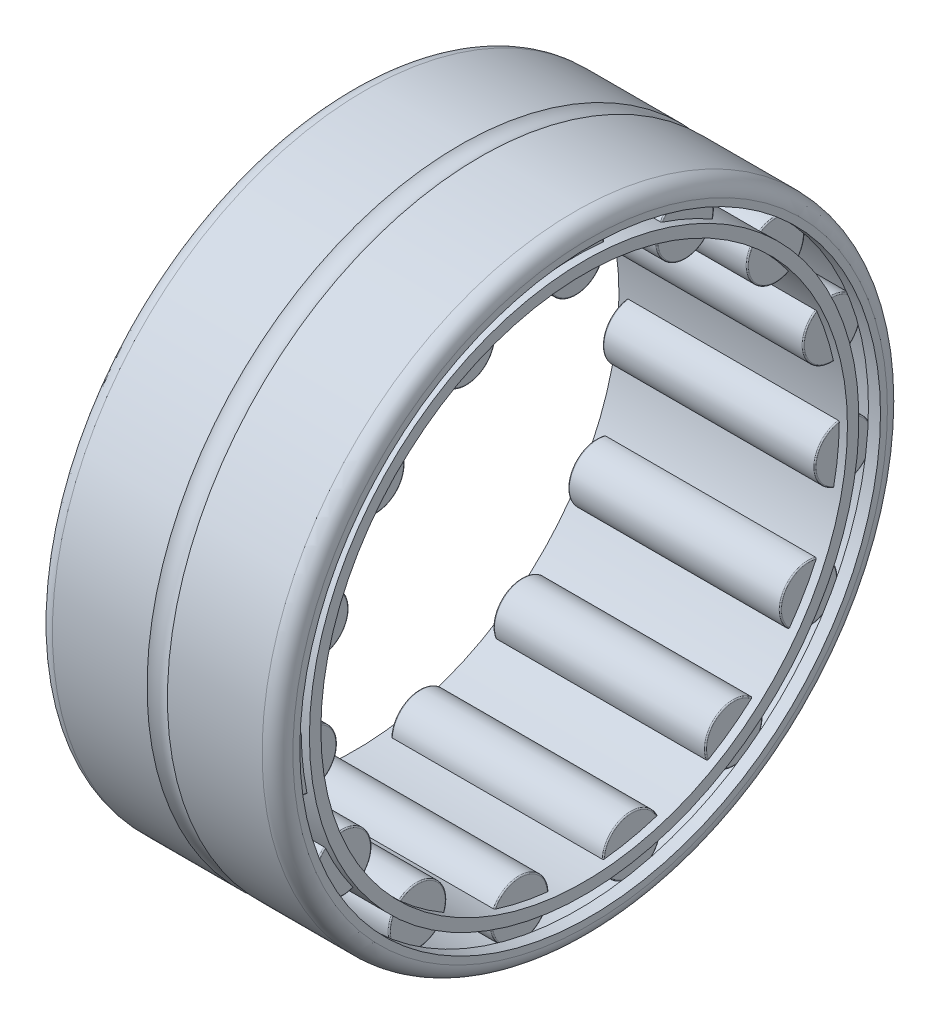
SolidWorks part; units mm, degrees
ref_plane "Plane1" through (0, 0, 0) normal (0, 0, 1) x (1, 0, 0)
ref_plane "Plane2" through (0, 0, 0) normal (0, 1, 0) x (1, 0, 0)
ref_plane "Plane3" through (0, 0, 0) normal (1, 0, 0) x (0, 0, -1)
sketch "Clipboard" plane through (0, 0, 0) normal (0, 0, 1) x (1, 0, 0)
  line L0 (-10, 0) -> (10, 0) construction
  line L1 (41.1529, 1.4371) -> (62.7517, -4.3503)
  line L2 (41.1529, 1.4371) -> (75.4583, 10.6292)
  line L3 (41.1529, 1.4371) -> (62.7517, -4.3503)
  line L4 (41.1529, 1.4371) -> (-22.3471, -0.7804)
  dimension "BallCLRad" = 35.5155
  dimension "Count" = 15
  dimension "Show_count" = 15
  dimension "Max_count" = 15
  dimension "Min_count" = 2
  dimension "Bore" = 63.5
sketch "InnRacSke" plane through (0, 0, 0) normal (0, 0, 1) x (1, 0, 0)
  line L0 (-14.2875, 38.3286) -> (-15.875, 38.3286)
  line L1 (-15.875, 38.3286) -> (-15.875, 39.243)
  line L2 (-13.843, 41.275) -> (-1.344, 41.275)
  line L3 (1.344, 41.275) -> (13.843, 41.275)
  line L4 (15.875, 39.243) -> (15.875, 38.3286)
  line L5 (15.875, 38.3286) -> (14.2875, 38.3286)
  line L6 (14.2875, 38.3286) -> (14.2875, 39.2811)
  line L7 (14.2875, 39.2811) -> (-14.2875, 39.2811)
  line L8 (-14.2875, 39.2811) -> (-14.2875, 38.3286)
  line L9 (-31.75, 0) -> (31.75, 0) construction
  arc A0 (-15.875, 39.243) -> (-13.843, 41.275) centre (-13.843, 39.243) cw
  arc A1 (-1.344, 41.275) -> (1.344, 41.275) centre (0, 42.799) ccw
  arc A2 (13.843, 41.275) -> (15.875, 39.243) centre (13.843, 39.243) cw
  dimension "radius" = 2.032
  dimension "D1" = 78.5622
  dimension "OD" = 82.55
  dimension "Width" = 31.75
  dimension "groove_dp" = 0.9525
  dimension "Cyl_Len" = 28.575
  dimension "offset" = 1.524
  dimension "halfCyl" = 14.2875
revolve "Race" add sketch "InnRacSke" angle 360 about L9
sketch "RolDetSke" plane through (0, 0, 0) normal (0, 0, 1) x (1, 0, 0)
  line L0 (-14.0018, 39.1427) -> (-14.0017, 35.5155)
  line L1 (-14.0017, 35.5155) -> (14.0017, 35.5155)
  line L2 (14.0017, 35.5155) -> (14.0018, 39.1427)
  line L3 (13.8506, 39.2938) -> (-13.8506, 39.2938)
  line L4 (-28.575, 35.5155) -> (28.575, 35.5155) construction
  arc A0 (14.0018, 39.1427) -> (13.8506, 39.2938) centre (13.8506, 39.1427) ccw
  arc A1 (-13.8506, 39.2938) -> (-14.0018, 39.1427) centre (-13.8506, 39.1427) ccw
  dimension "Roller_radius" = 0.1511
  dimension "Roller_diameter" = 7.5565
  dimension "Roller_length" = 28.0035
  dimension "RollerCLRad" = 35.5155
  dimension "halfLength" = 14.0017
revolve "RollerDetailed" add sketch "RolDetSke" angle 360 about L4
ref_axis "Axis1" through (-50, 0, 0) along (1, 0, 0)
sketch "CagSpiSke" plane through (0, 0, 0) normal (0, 0, 1) x (1, 0, 0)
  line L0 (15.0812, 34.7599) -> (15.0812, 36.2712)
  line L1 (15.0812, 36.2712) -> (-15.0813, 36.2712)
  line L2 (-15.0813, 36.2712) -> (-15.0813, 34.7599)
  line L3 (-15.0813, 34.7599) -> (15.0812, 34.7599)
  line L4 (-31.75, 0) -> (31.75, 0) construction
  dimension "Cage_width" = 30.1625
  dimension "D2" = 69.5198
  dimension "Cage_thickness" = 1.5113
  dimension "halfWidth" = 15.0812
revolve "CageSpine" add sketch "CagSpiSke" angle 360 about L4
pattern_circular "RollersDetailed" count 15 every 24 about axis through (-50, 0, 0) along (1, 0, 0) of "RollerDetailed"
sketch "RolSimSke" plane through (0, 0, 0) normal (0, 0, 1) x (1, 0, 0)
  line L0 (-25.4, 0) -> (25.4, 0) construction
  line L2 (-13.8506, 39.3065) -> (13.8506, 39.3065)
  line L3 (-14.0018, 39.1554) -> (-14.0018, 31.9011)
  line L4 (-13.8506, 31.75) -> (13.8506, 31.75)
  line L5 (14.0017, 39.1554) -> (14.0017, 31.9011)
  arc A0 (-14.0018, 31.9011) -> (-13.8506, 31.75) centre (-13.8506, 31.9011) ccw
  arc A1 (-13.8506, 39.3065) -> (-14.0018, 39.1554) centre (-13.8506, 39.1554) ccw
  arc A2 (14.0017, 39.1554) -> (13.8506, 39.3065) centre (13.8506, 39.1554) ccw
  arc A3 (13.8506, 31.75) -> (14.0017, 31.9011) centre (13.8506, 31.9011) ccw
  point P10 (-14.0018, 31.75)
  point P15 (14.0017, 39.3065)
  point P18 (14.0017, 31.75)
  dimension "D1" = 0.1511
  dimension "Bore" = 63.5
  dimension "Roller_length" = 28.0035
  dimension "Roller_diameter" = 7.5565
  dimension "halfWidth" = 14.0017
revolve "RollersSimplified" [suppressed] add sketch "RolSimSke" angle 360 about L0
equation "\"BallCLRad@Clipboard\" =  ( \"D1@InnRacSke\" + \"Bore@Clipboard\" )  / 4"
equation "\"RollerCLRad@RolDetSke\" = \"BallCLRad@Clipboard\""
equation "\"offset@InnRacSke\" = \"radius@InnRacSke\" * .75"
equation "\"halfCyl@InnRacSke\" = \"Cyl_Len@InnRacSke\" / 2"
equation "\"Roller_diameter@RolDetSke\" =  ( \"D1@InnRacSke\" - \"Bore@Clipboard\" )  / 2 + .001"
equation "\"Roller_radius@RolDetSke\" = \"Roller_diameter@RolDetSke\" / 50"
equation "\"Roller_length@RolDetSke\" = \"Cyl_Len@InnRacSke\" * .98"
equation "\"halfLength@RolDetSke\" = \"Roller_length@RolDetSke\" / 2"
equation "\"Cage_width@CagSpiSke\" =  ( \"Cyl_Len@InnRacSke\" + \"Width@InnRacSke\" )  / 2"
equation "\"halfWidth@CagSpiSke\" = \"Cage_width@CagSpiSke\" / 2"
equation "\"Cage_thickness@CagSpiSke\"  = \"Roller_diameter@RolDetSke\" / 5"
equation "\"D2@CagSpiSke\" =  \"RollerCLRad@RolDetSke\" * 2 - \"Cage_thickness@CagSpiSke\""
equation "\"Roller_length@RolSimSke\" = \"Cyl_Len@InnRacSke\" * .98"
equation "\"halfWidth@RolSimSke\" = \"Roller_length@RolSimSke\" / 2"
equation "\"D1@RolSimSke\" = \"Roller_radius@RolDetSke\""
equation "\"Roller_diameter@RolSimSke\" =  ( \"D1@InnRacSke\" - \"Bore@Clipboard\" )  / 2 + .001"
equation "\"Max_count@Clipboard\" = int( 3.14159265 / atn(( \"Roller_diameter@RolDetSke\" / 2) / sqr( \"RollerCLRad@RolDetSke\"  *  \"RollerCLRad@RolDetSke\" - ( \"Roller_diameter@RolDetSke\" / 2) *  ( \"Roller_diameter@R"
equation "\"Max_count@Clipboard\" = ((sgn( \"Max_count@Clipboard\" - \"Count@Clipboard\" )-1)*( \"Max_count@Clipboard\" - \"Count@Clipboard\" ))/-2+ \"Count@Clipboard\""
equation "\"Count@RollersDetailed\" = int( \"Show_count@Clipboard\" ) "
equation "\"Count@RollersDetailed\" = ((sgn( \"Count@RollersDetailed\" - \"Max_count@Clipboard\" )-1)*( \"Count@RollersDetailed\" - \"Max_count@Clipboard\" ))/-2+ \"Max_count@Clipboard\""
equation "\"Count@RollersDetailed\" = ((sgn( \"Count@RollersDetailed\" - \"Min_count@Clipboard\" )+1)*( \"Count@RollersDetailed\" - \"Min_count@Clipboard\"))/2 +\"Min_count@Clipboard\""
equation "\"Angle@RollersDetailed\" = 360.0 / \"Max_count@Clipboard\""
equation "\"Angle@CageSpine\" =  \"Angle@RollersDetailed\" * ( \"Count@RollersDetailed\" -1 + int( \"Count@RollersDetailed\" / \"Max_count@Clipboard\" ) )  + 0.001 -  int( \"Count@RollersDetailed\" / \"Max_count@Clipboard\" "
equation "\"Angle@CageSpine\" =  \"Angle@CageSpine\" * int( \"Min_count@Clipboard\" / 2) + int(1 / \"Min_count@Clipboard\")  * 0.001"
equation "\"Bore@RolSimSke\" = \"Bore@Clipboard\""
